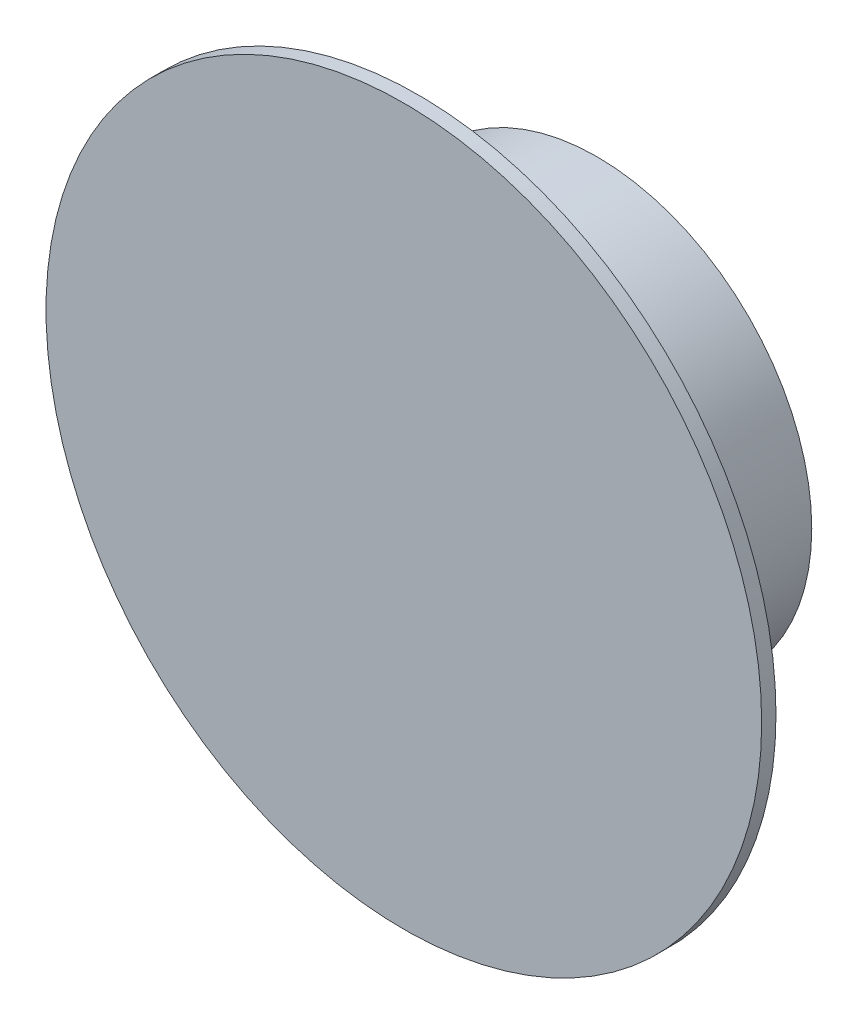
SolidWorks part; units mm, degrees
ref_plane "Alzado" through (0, 0, 0) normal (0, 0, 1) x (1, 0, 0)
ref_plane "Planta" through (0, 0, 0) normal (0, 1, 0) x (1, 0, 0)
ref_plane "Vista lateral" through (0, 0, 0) normal (1, 0, 0) x (0, 0, -1)
sketch "Croquis1" plane through (0, 0, 0) normal (0, 0, 1) x (1, 0, 0)
  circle A0 centre (0, 0) radius 30
  dimension "D1" = 60
extrude "Saliente-Extruir1" add sketch "Croquis1" along normal blind 25
fillet "Redondeo1" radius 2 1 edges at (30, 0, 25)
shell "Vaciado1" thickness 1.5
sketch "Croquis2" plane through (0, 0, 25) normal (0, 0, 1) x (1, 0, 0)
  circle A0 centre (0, 0) radius 50
  dimension "D1" = 100
extrude "Saliente-Extruir2" add sketch "Croquis2" along normal blind 2 separate body
